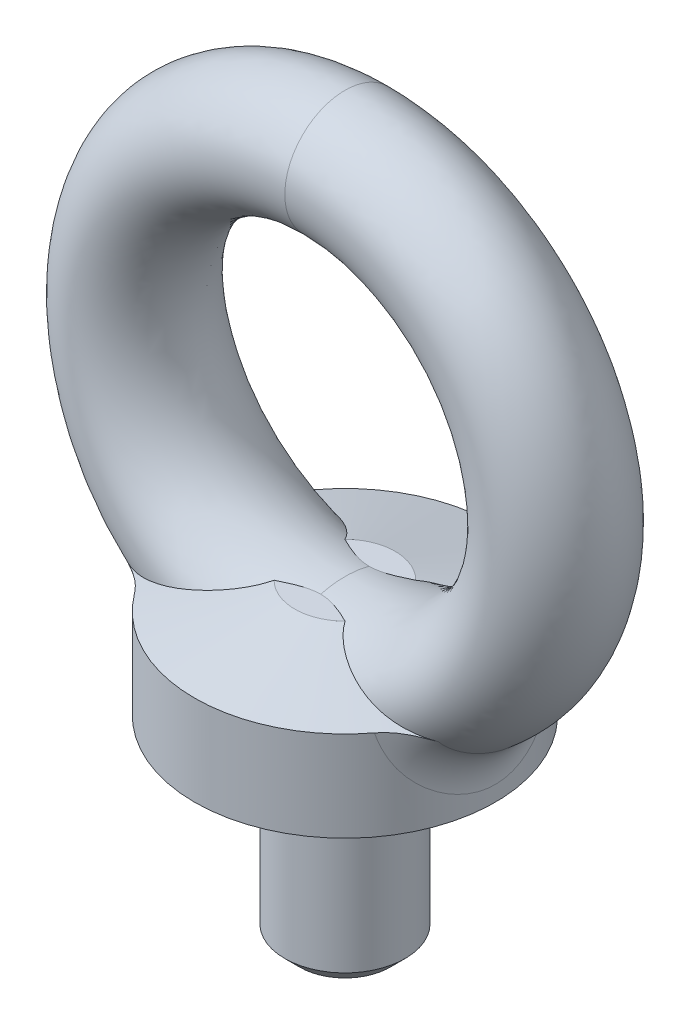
SolidWorks part; units mm, degrees
ref_plane "Front" through (0, 0, 0) normal (0, 0, 1) x (1, 0, 0)
ref_plane "Top" through (0, 0, 0) normal (0, 1, 0) x (1, 0, 0)
ref_plane "Right" through (0, 0, 0) normal (1, 0, 0) x (0, 0, -1)
sketch "Sketch1" plane through (0, 0, 0) normal (0, 0, 1) x (1, 0, 0)
  line L0 (0, 29.5419) -> (0, -28.9357) construction
  line L1 (-28.3559, -18) -> (21.4097, -18) construction
  arc A0 (0, -10) -> (0, 10) centre (0, 0) ccw
  arc A1 (0, -18) -> (0, 18) centre (0, 0) ccw
  dimension "D3" = 36
  dimension "D4" = 20
  dimension "h" = 36
sketch "Sketch2" plane through (0, 0, 0) normal (1, 0, 0) x (0, 0, -1)
  circle A0 centre (0, 14) radius 4
  point P2 (0, 18)
  point P6 (0, 10)
sketch "Sketch3" plane through (0, 0, 0) normal (1, 0, 0) x (0, 0, -1)
  ellipse E0 centre (0, -14) end of major axis (-5, -14) minor radius 4
  dimension "m" = 10
loft "Loft1" add profiles "Sketch2", "Sketch3"
mirror "Mirror1" about plane through (0, 0, 0) normal (1, 0, 0)
sketch "Sketch4" plane through (0, 0, 0) normal (0, 0, 1) x (1, 0, 0)
  line L0 (10, -12) -> (10, -18)
  line L1 (-28.3559, -18) -> (21.4097, -18) construction
  line L2 (10, -12) -> (3.3333, -10.2137)
  line L3 (3.3333, -10.2137) -> (0, -10.2137)
  line L4 (0, 29.5419) -> (0, -28.9357) construction
  line L5 (3, -18) -> (3, -19.3453)
  line L6 (3.5, -20.2113) -> (4, -20.5)
  line L7 (4, -20.5) -> (4, -31)
  line L8 (4, -31) -> (0, -31)
  line L9 (0, -2.475) -> (0, -32.5334) construction
  line L10 (10, -18) -> (6, -18)
  line L11 (6, -18) -> (4.5, -17.134)
  line L12 (0, -10.2137) -> (0, -31)
  arc A0 (4.5, -17.134) -> (3, -18) centre (4, -18) ccw
  arc A3 (3, -19.3453) -> (3.5, -20.2113) centre (4, -19.3453) ccw
  dimension "r2" = 1
  dimension "r3" = 1
  dimension "f" = 2.5
  dimension "d2" = 20
  dimension "e" = 6
  dimension "D9" = 15
  dimension "D8" = 6.6667
  dimension "g" = 6
  dimension "d1" = 8
  dimension "D4" = 30
  dimension "l" = 13
revolve "Revolve1" add sketch "Sketch4" angle 360 about L9
chamfer "Chamfer1" distance 1 angle 45 1 edges at (0, -31, 4)
fillet "Fillet1" radius 4 2 edges at (-9.9818, -14.9391, -0.6027) (9.9818, -14.9391, 0.6027)
sketch "Sketch5" plane through (0, 0, 0) normal (0, 0, 1) x (1, 0, 0)
  line L0 (0, 0) -> (0, -37.4241) construction
  line L1 (4, -20.2998) -> (5, -20.2998)
  line L2 (5, -20.2998) -> (5, -21.7002)
  line L3 (5, -21.7002) -> (4, -21.7002)
  line L4 (4, -21.7002) -> (3, -21)
  line L5 (3, -21) -> (4, -20.2998)
  line L6 (-6, -18) -> (6, -18) construction
  dimension "D1" = 6
  dimension "D2" = 8
  dimension "advance" = 1
  dimension "D4" = 70
  dimension "D5" = 3
revolve "ThreadSchematic" [suppressed] cut sketch "Sketch5" angle 360 about L0
pattern_linear "ThdSchPat" [suppressed] count 10 spacing 1 along (0, -1, 0)
equation "\"D8@Sketch4\" = \"D4@Sketch1\" / 3"
equation "\"D1@ThreadCosmetic\" = \"l@Sketch4\" - \"f@Sketch4\""
equation "\"D1@Sketch5\" = \"D2@ThreadCosmetic\""
equation "\"d5@sketch5\" = \"f@sketch4\" + (\"advance@sketch5\" / 2.0)"
equation "\"d1@ThdSchPat\" = int(((\"l@sketch4\" - \"f@sketch4\") / \"advance@sketch5\") + 0.0)"
